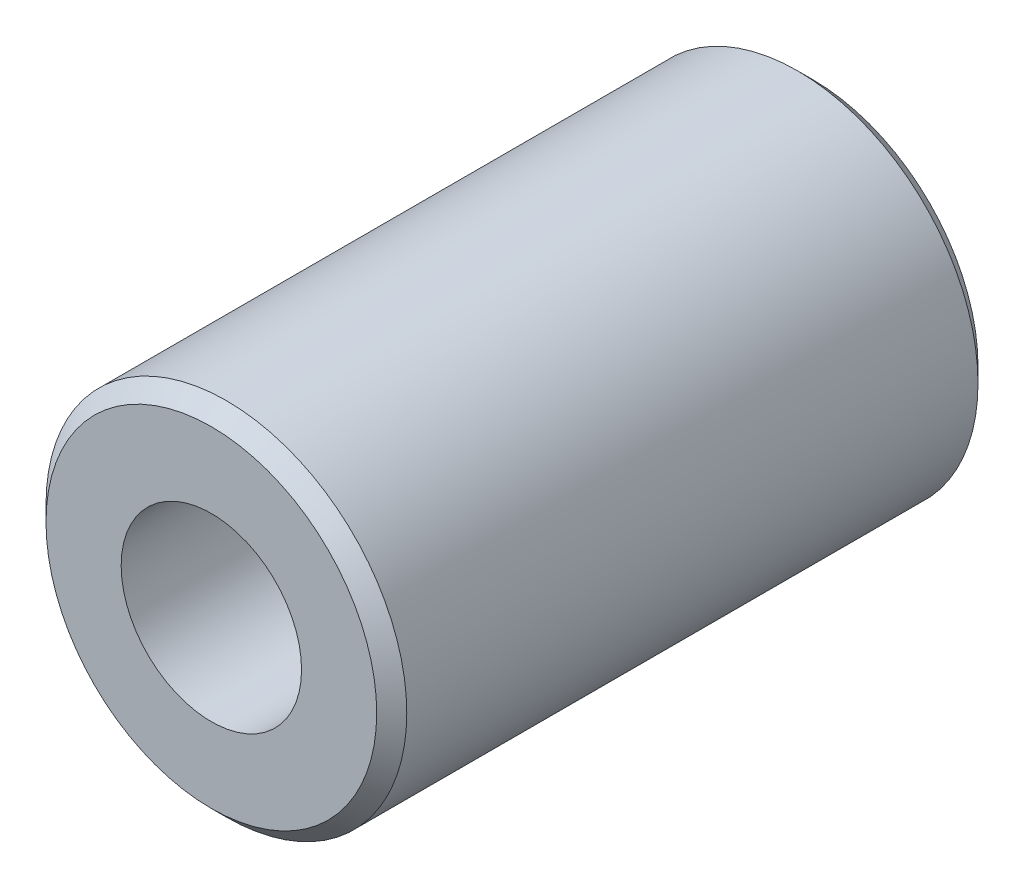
SolidWorks part; units mm, degrees
ref_plane "Plan de face" through (0, 0, 0) normal (0, 0, 1) x (1, 0, 0)
ref_plane "Plan de dessus" through (0, 0, 0) normal (0, 1, 0) x (1, 0, 0)
ref_plane "Plan de droite" through (0, 0, 0) normal (1, 0, 0) x (0, 0, -1)
sketch "Esquisse1" plane through (0, 0, 0) normal (0, 0, 1) x (1, 0, 0)
  circle A0 centre (0, 0) radius 6
  circle A1 centre (0, 0) radius 3
  dimension "D1" = 6
  dimension "D2" = 12
extrude "Boss.-Extru.1" add sketch "Esquisse1" along normal mid plane 20
chamfer "Chanfrein1" distance 0.5 angle 45 2 edges at (6, 0, -10) (6, 0, 10)
